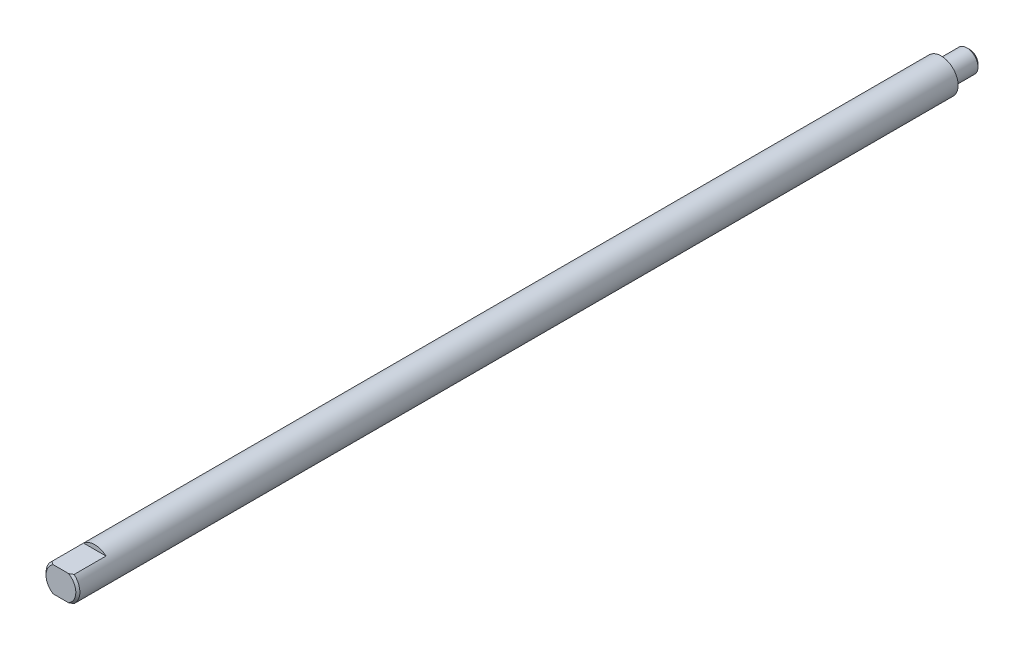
SolidWorks part; units mm, degrees
ref_plane "Front" through (0, 0, 0) normal (0, 0, 1) x (1, 0, 0)
ref_plane "Top" through (0, 0, 0) normal (0, 1, 0) x (1, 0, 0)
ref_plane "Right" through (0, 0, 0) normal (1, 0, 0) x (0, 0, -1)
sketch "Sketch1" plane through (0, 0, 0) normal (1, 0, 0) x (0, 0, -1)
  line L0 (166.366, 1.5728) -> (165.856, 2.0828)
  line L1 (-4.064, 0) -> (166.366, 0)
  line L2 (-4.064, 0) -> (-4.064, 2.79)
  line L3 (-3.684, 3.175) -> (161.036, 3.175)
  line L4 (161.036, 2.0828) -> (161.036, 3.175)
  line L5 (153.7168, 0) -> (50153.7168, 0) construction
  line L6 (-4.064, 2.79) -> (-3.684, 3.175)
  line L7 (161.036, 2.0828) -> (165.856, 2.0828)
  line L8 (166.366, 0) -> (166.366, 1.5728)
  point P2 (0, 0)
  point P12 (-25.6379, 14.7115)
  dimension "D1" = 165.1
  dimension "D2" = 5.33
  dimension "D3" = 6.35
  dimension "D4" = 4.1656
  dimension "D5" = 45
  dimension "D6" = 0.51
  dimension "D7" = 2.79
  dimension "D8" = 0.38
  dimension "D9" = 4.064
revolve "Revolve1" add sketch "Sketch1" angle 360 about L1
sketch "Sketch2" plane through (0, 0, 0) normal (1, 0, 0) x (0, 0, -1)
  line L0 (-4.064, 2.79) -> (-4.064, -2.79) construction
  line L1 (-4.064, 2.375) -> (2.286, 2.375)
  line L2 (-4.064, 2.375) -> (-4.064, 3.175)
  line L3 (-4.064, 3.175) -> (2.286, 3.175)
  line L4 (2.286, 2.375) -> (2.286, 3.175)
  line L5 (161.036, 3.175) -> (-3.684, 3.175) construction
  line L6 (-4.064, 0) -> (6.0404, 0) construction
  line L7 (2.286, -2.375) -> (2.286, -3.175)
  line L8 (-4.064, -3.175) -> (2.286, -3.175)
  line L9 (-4.064, -2.375) -> (-4.064, -3.175)
  line L10 (-4.064, -2.375) -> (2.286, -2.375)
  dimension "D1" = 0.8
  dimension "D2" = 6.35
extrude "Cut-Extrude1" cut sketch "Sketch2" against normal mid plane 10
